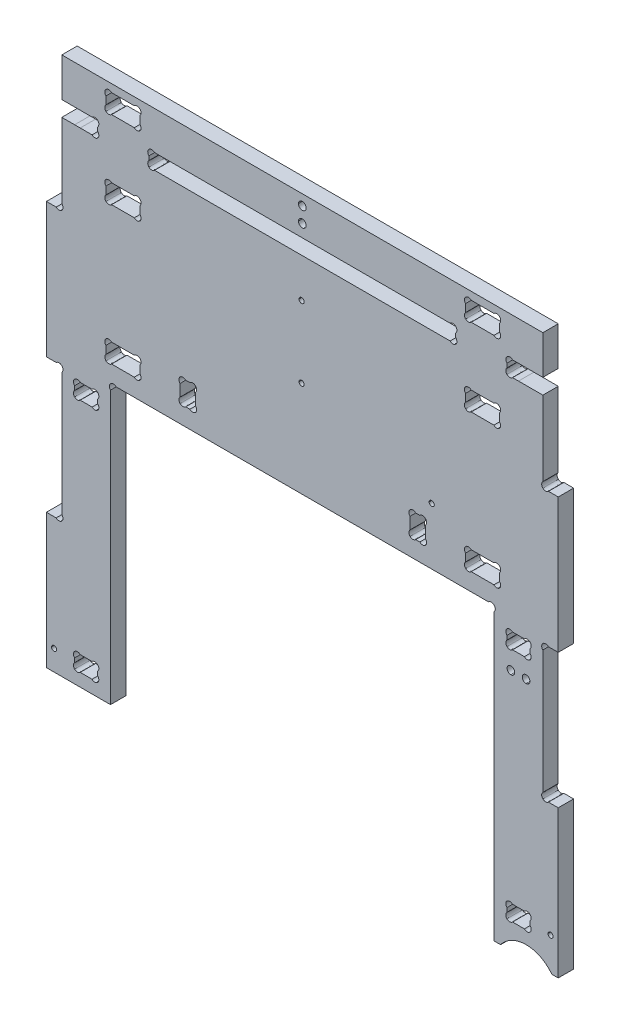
SolidWorks part; units mm, degrees
ref_plane "Plan de face" through (0, 0, 0) normal (0, 0, 1) x (1, 0, 0)
ref_plane "Plan de dessus" through (0, 0, 0) normal (0, 1, 0) x (1, 0, 0)
ref_plane "Plan de droite" through (0, 0, 0) normal (1, 0, 0) x (0, 0, -1)
body saved out of another part "Stock-Pièce3-1"
sketch "Esquisse1" plane through (0, 0, 6) normal (0, 0, 1) x (1, 0, 0)
  line L0 (2319.6704, 205.12) -> (2315.0545, 205.1203) construction
  line L1 (2317.3625, 205.1202) -> (2301.958, 205.1202)
  line L2 (2317.3625, 205.1202) -> (2317.3625, 211.1202)
  line L3 (2317.3625, 211.1202) -> (2301.958, 211.1202)
  line L4 (2301.958, 205.1202) -> (2301.958, 211.1202)
  line L5 (2483.6962, 205.1106) -> (2488.3122, 205.1103) construction
  line L6 (2486.0042, 205.1104) -> (2500.1191, 205.1104)
  line L7 (2486.0042, 205.1104) -> (2486.0042, 211.1104)
  line L8 (2486.0042, 211.1104) -> (2500.1191, 211.1104)
  line L9 (2500.1191, 205.1104) -> (2500.1191, 211.1104)
  point P12 (2486.0045, 211.1104)
  point P13 (2317.3628, 211.1202)
extrude "Enlèv. mat.-Extru.1" cut sketch "Esquisse1" against normal through all
sketch "Esquisse2" plane through (0, 0, 6) normal (0, 0, 1) x (1, 0, 0)
  line L0 (2315.0548, 211.1203) -> (2319.6708, 211.12) construction
  line L1 (2317.3628, 211.1202) -> (2310.8593, 211.1202)
  line L2 (2317.3628, 211.1202) -> (2317.3628, 212.7213)
  line L3 (2317.3628, 212.7213) -> (2310.8593, 212.7213)
  line L4 (2310.8593, 211.1202) -> (2310.8593, 212.7213)
  line L5 (2319.6704, 205.12) -> (2315.0544, 205.1202) construction
  line L6 (2317.3624, 205.1201) -> (2311.2788, 205.1201)
  line L7 (2317.3624, 205.1201) -> (2317.3624, 204.0687)
  line L8 (2317.3624, 204.0687) -> (2311.2788, 204.0687)
  line L9 (2311.2788, 205.1201) -> (2311.2788, 204.0687)
  line L10 (2488.3126, 211.1104) -> (2483.6966, 211.1106) construction
  line L11 (2486.0046, 211.1105) -> (2492.7107, 211.1105)
  line L12 (2486.0046, 211.1105) -> (2486.0046, 213.2503)
  line L13 (2486.0046, 213.2503) -> (2492.7107, 213.2503)
  line L14 (2492.7107, 211.1105) -> (2492.7107, 213.2503)
  line L15 (2483.6962, 205.1106) -> (2488.3122, 205.1103) construction
  line L16 (2486.0042, 205.1104) -> (2493.1074, 205.1104)
  line L17 (2486.0042, 205.1104) -> (2486.0042, 203.2539)
  line L18 (2486.0042, 203.2539) -> (2493.1074, 203.2539)
  line L19 (2493.1074, 205.1104) -> (2493.1074, 203.2539)
extrude "Boss.-Extru.1" add sketch "Esquisse2" against normal up to surface (6 mm away)
